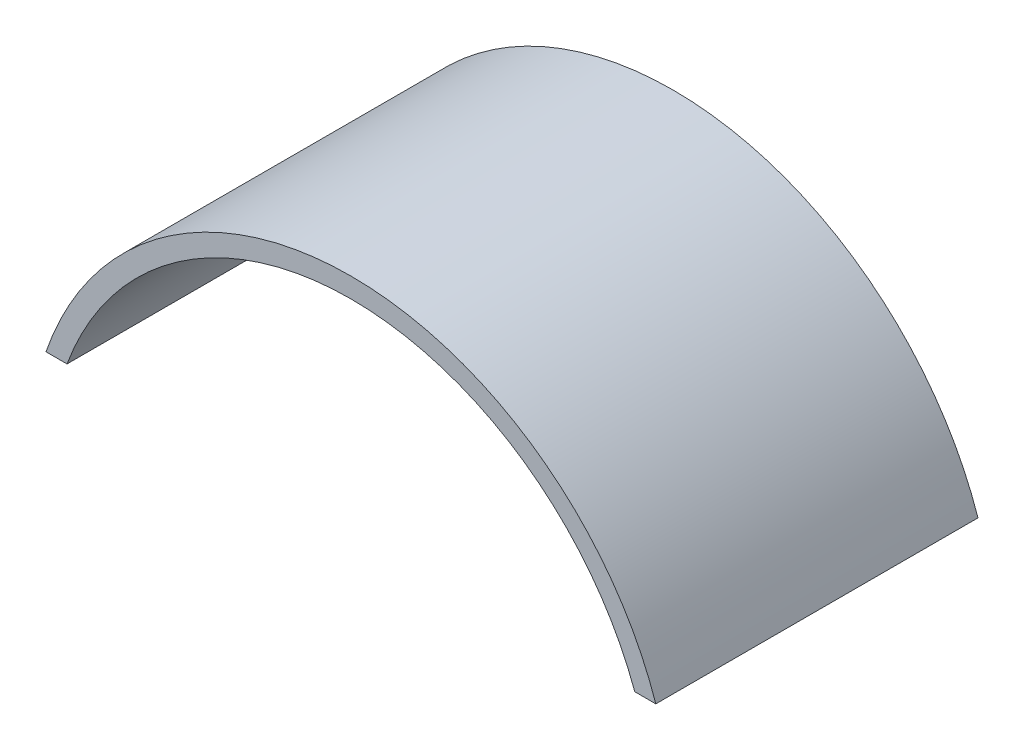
SolidWorks part; units mm, degrees
ref_plane "前视基准面" through (0, 0, 0) normal (0, 0, 1) x (1, 0, 0)
ref_plane "上视基准面" through (0, 0, 0) normal (0, 1, 0) x (1, 0, 0)
ref_plane "右视基准面" through (0, 0, 0) normal (1, 0, 0) x (0, 0, -1)
sketch "草图1" plane through (0, 0, 0) normal (0, 0, 1) x (1, 0, 0)
  line L0 (-123.0285, 42) -> (-114.5426, 42)
  line L1 (114.5426, 42) -> (123.0285, 42)
  arc A0 (123.0285, 42) -> (-123.0285, 42) centre (0, 0) ccw
  arc A1 (114.5426, 42) -> (-114.5426, 42) centre (0, 0) ccw
  dimension "D1" = 260
  dimension "D2" = 244
  dimension "D3" = 88
extrude "拉伸1" add sketch "草图1" along normal blind 130
